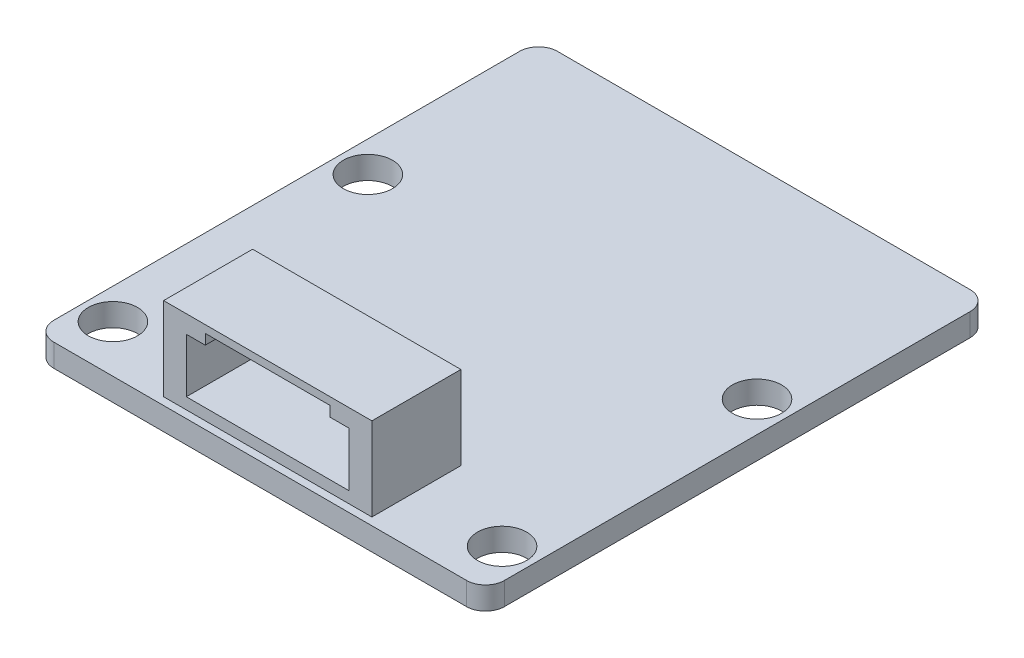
SolidWorks part; units mm, degrees
ref_plane "Front Plane" through (0, 0, 0) normal (0, 0, 1) x (1, 0, 0)
ref_plane "Top Plane" through (0, 0, 0) normal (0, 1, 0) x (1, 0, 0)
ref_plane "Right Plane" through (0, 0, 0) normal (1, 0, 0) x (0, 0, -1)
sketch "Sketch1" plane through (0, 0, 0) normal (0, 1, 0) x (1, 0, 0)
  line L1 (-15.113, 16.891) -> (0, 16.891)
  line L2 (-15.113, 16.891) -> (-15.113, -16.891)
  line L3 (-15.113, -16.891) -> (0, -16.891)
  line L4 (0, 16.891) -> (0, -16.891)
  line L5 (-15.113, 16.891) -> (0, -16.891) construction
  line L6 (-15.113, -16.891) -> (0, 16.891) construction
  point P0 (-7.5565, 0)
  dimension "D1" = 15.113
  dimension "D2" = 33.782
extrude "Boss-Extrude1" add sketch "Sketch1" along normal blind 1.524
fillet "Fillet1" radius 1.27 2 edges at (-15.113, 0.762, -16.891) (-15.113, 0.762, 16.891)
sketch "Sketch2" plane through (0, 1.524, 0) normal (0, 1, 0) x (1, 0, 0)
  line L2 (-13.843, -16.891) -> (0, -16.891) construction
  circle A0 centre (-13.0505, -13.716) radius 1.651
  circle A1 centre (-13.0505, 3.3833) radius 1.651
  dimension "D1" = 3.302
  dimension "D4" = 3.175
  dimension "D2" = 13.0505
  dimension "D3" = 17.0993
extrude "Cut-Extrude1" cut sketch "Sketch2" against normal through all
sketch "Sketch3" plane through (0, 1.524, 0) normal (0, 1, 0) x (1, 0, 0)
  line L0 (0, -16.891) -> (0, 16.891) construction
  line L1 (0, -10.414) -> (-6.985, -10.414)
  line L2 (0, -10.414) -> (0, -16.383)
  line L3 (0, -16.383) -> (-6.985, -16.383)
  line L4 (-6.985, -10.414) -> (-6.985, -16.383)
  line L5 (-13.843, -16.891) -> (0, -16.891) construction
  dimension "D1" = 6.985
  dimension "D2" = 5.969
  dimension "D3" = 0.508
extrude "Boss-Extrude2" add sketch "Sketch3" along normal blind 5.588
sketch "Sketch4" plane through (0, 0, 16.383) normal (0, 0, 1) x (1, 0, 0)
  line L0 (0, 7.112) -> (0, 1.524) construction
  line L1 (-4.191, 5.9182) -> (-5.461, 5.9182)
  line L2 (0, 5.9182) -> (0, 2.286)
  line L3 (0, 2.286) -> (-5.461, 2.286)
  line L4 (-5.461, 5.9182) -> (-5.461, 2.286)
  line L5 (-6.985, 1.524) -> (0, 1.524) construction
  line L6 (-6.985, 7.112) -> (0, 7.112) construction
  line L7 (-6.985, 7.112) -> (-6.985, 1.524) construction
  line L8 (-4.191, 5.9182) -> (-4.191, 6.604)
  line L9 (-4.191, 6.604) -> (0, 6.604)
  line L10 (0, 6.604) -> (0, 5.9182)
  dimension "D1" = 0.762
  dimension "D2" = 1.1938
  dimension "D3" = 1.524
  dimension "D4" = 0.508
  dimension "D5" = 1.27
extrude "Cut-Extrude2" cut sketch "Sketch4" against normal blind 5.08
mirror "Mirror1" about plane through (0, 1.524, -16.891) normal (-1, 0, 0) of "Cut-Extrude2", "Boss-Extrude2", "Cut-Extrude1", "Fillet1", "Boss-Extrude1"
